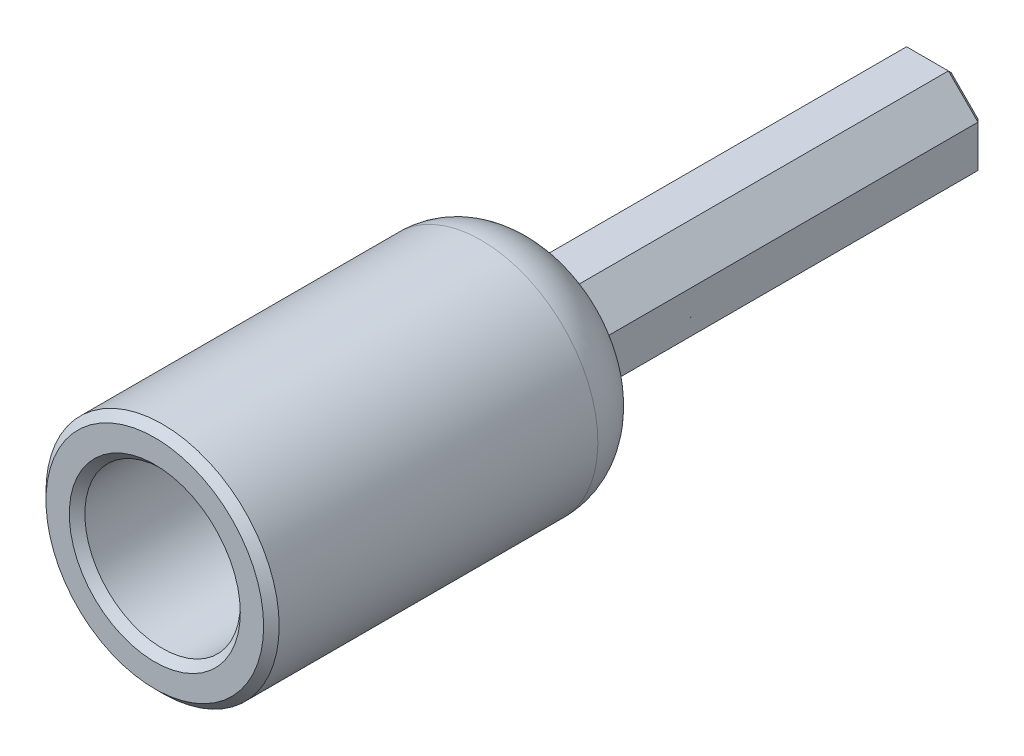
SolidWorks part; units mm, degrees
ref_plane "Front Plane" through (0, 0, 0) normal (0, 0, 1) x (1, 0, 0)
ref_plane "Top Plane" through (0, 0, 0) normal (0, 1, 0) x (1, 0, 0)
ref_plane "Right Plane" through (0, 0, 0) normal (1, 0, 0) x (0, 0, -1)
sketch "Sketch1" plane through (0, 0, 0) normal (0, 0, 1) x (1, 0, 0)
  circle A0 centre (0, 0) radius 7.5
  dimension "D1" = 15
extrude "Boss-Extrude1" add sketch "Sketch1" along normal blind 25
sketch "Sketch2" plane through (0, 0, 0) normal (0, 0, -1) x (-1, 0, 0)
  line L7 (1.3462, 3.25) -> (-1.3462, 3.25)
  line L8 (-1.3462, 3.25) -> (-3.25, 1.3462)
  line L9 (-3.25, 1.3462) -> (-3.25, -1.3462)
  line L10 (-3.25, -1.3462) -> (-1.3462, -3.25)
  line L11 (-1.3462, -3.25) -> (1.3462, -3.25)
  line L12 (1.3462, -3.25) -> (3.25, -1.3462)
  line L13 (3.25, -1.3462) -> (3.25, 1.3462)
  line L14 (3.25, 1.3462) -> (1.3462, 3.25)
  circle A0 centre (0, 0) radius 3.25 construction
  dimension "D1" = 6.5
extrude "Boss-Extrude2" add sketch "Sketch2" along normal blind 25
sketch "Sketch4" plane through (0, 0, -25) normal (0, 0, -1) x (-1, 0, 0)
  circle A0 centre (0, 0) radius 2.5
  dimension "D1" = 5
extrude "Cut-Extrude2" cut sketch "Sketch4" against normal through all
sketch "Sketch5" plane through (0, 0, 25) normal (0, 0, 1) x (1, 0, 0)
  circle A0 centre (0, 0) radius 5
  dimension "D1" = 10
extrude "Cut-Extrude3" cut sketch "Sketch5" against normal blind 12
chamfer "Chamfer1" distance 0.5 angle 45 2 edges at (5, 0, 25) (7.5, 0, 25)
chamfer "Chamfer2" distance 0.3 angle 45 8 edges at (0, -3.25, -25) (2.2981, -2.2981, -25) (3.25, 0, -25) (2.2981, 2.2981, -25) (0, 3.25, -25) (-2.2981, 2.2981, -25) (-3.25, 0, -25) (-2.2981, -2.2981, -25)
fillet "Fillet2" radius 4 1 edges at (7.5, 0, 0)
sketch "Sketch3" plane through (0, 0, 0) normal (1, 0, 0) x (0, 0, -1)
  line L14 (-4.3, -7.5) -> (0, -3.2167)
  line L15 (0, -3.2167) -> (0, -7.5)
  line L16 (0, -7.5) -> (-4.3, -7.5)
  point P2 (-4, -7.5)
  dimension "D1" = 4.3
extrude "Cut-Extrude1" cut sketch "Sketch3" against normal through all both and the other way through all
